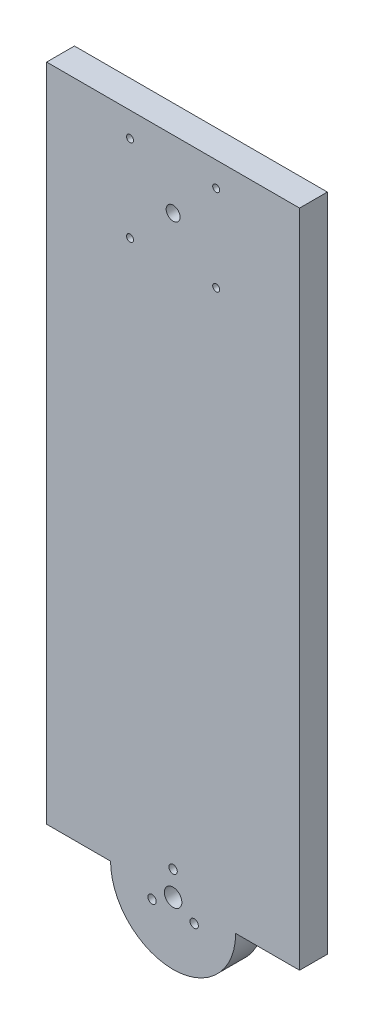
SolidWorks part; units mm, degrees
ref_plane "Front Plane" through (0, 0, 0) normal (0, 0, 1) x (1, 0, 0)
ref_plane "Top Plane" through (0, 0, 0) normal (0, 1, 0) x (1, 0, 0)
ref_plane "Right Plane" through (0, 0, 0) normal (1, 0, 0) x (0, 0, -1)
sketch "Sketch1" plane through (0, 0, 0) normal (0, 0, 1) x (1, 0, 0)
  line L0 (0, -1565.9861) -> (0, 76733.3209) construction
  line L1 (-22.5, 130) -> (22.5, 130)
  line L2 (-22.5, 130) -> (-22.5, -107.5)
  line L4 (22.5, 130) -> (22.5, -107.5)
  line L5 (-22.5, 130) -> (22.5, -130) construction
  line L6 (-22.5, -130) -> (22.5, 130) construction
  line L7 (-1565.9861, 0) -> (76733.3209, 0) construction
  line L8 (-42.7696, 105.6639) -> (42.7696, 105.6639) construction
  line L9 (-21.1, 126.7639) -> (21.1, 126.7639) construction
  line L10 (-21.1, 126.7639) -> (-21.1, 84.5639) construction
  line L11 (-21.1, 84.5639) -> (21.1, 84.5639) construction
  line L12 (21.1, 126.7639) -> (21.1, 84.5639) construction
  line L13 (-21.1, 126.7639) -> (21.1, 84.5639) construction
  line L14 (-21.1, 84.5639) -> (21.1, 126.7639) construction
  circle A0 centre (-15.5, 121.1639) radius 1.25
  circle A1 centre (15.5, 121.1639) radius 1.25
  circle A2 centre (15.5, 90.1639) radius 1.25
  circle A3 centre (-15.5, 90.1639) radius 1.25
  circle A4 centre (0, 105.6639) radius 2.5
  circle A5 centre (0, -107.5) radius 8.75 construction
  arc A6 (-22.5, -107.5) -> (22.5, -107.5) centre (0, -107.5) ccw
  circle A7 centre (0, -98.75) radius 1.5
  circle A8 centre (7.5777, -111.875) radius 1.5
  circle A9 centre (-7.5777, -111.875) radius 1.5
  circle A10 centre (0, -107.5) radius 3.15
  point P0 (0, 0)
  point P9 (0, 105.6639)
  point P20 (0, 105.6639)
  point P28 (0, 83.0234)
  point P46 (0, -107.5)
  dimension "D4" = 2.5
  dimension "D6" = 5
  dimension "D9" = 17.5
  dimension "D10" = 3
  dimension "D12" = 6.3
  dimension "D1" = 45
  dimension "D2" = 260
  dimension "D3" = 42.2
  dimension "D5" = 31
  dimension "D11" = 3
extrude "Boss-Extrude1" add sketch "Sketch1" along normal blind 10
sketch "Sketch2" plane through (22.5, 0, 0) normal (1, 0, 0) x (0, 0, -1)
  line L1 (-10, 130) -> (0, 130)
  line L2 (-10, 130) -> (-10, -107.5)
  line L3 (-10, -107.5) -> (0, -107.5)
  line L4 (0, 130) -> (0, -107.5)
extrude "Boss-Extrude2" add sketch "Sketch2" along normal blind 23
sketch "Sketch3" plane through (-22.5, 0, 0) normal (-1, 0, 0) x (0, 0, 1)
  line L1 (0, 130) -> (10, 130)
  line L2 (0, 130) -> (0, -107.5)
  line L3 (0, -107.5) -> (10, -107.5)
  line L4 (10, 130) -> (10, -107.5)
extrude "Boss-Extrude3" add sketch "Sketch3" along normal blind 23
